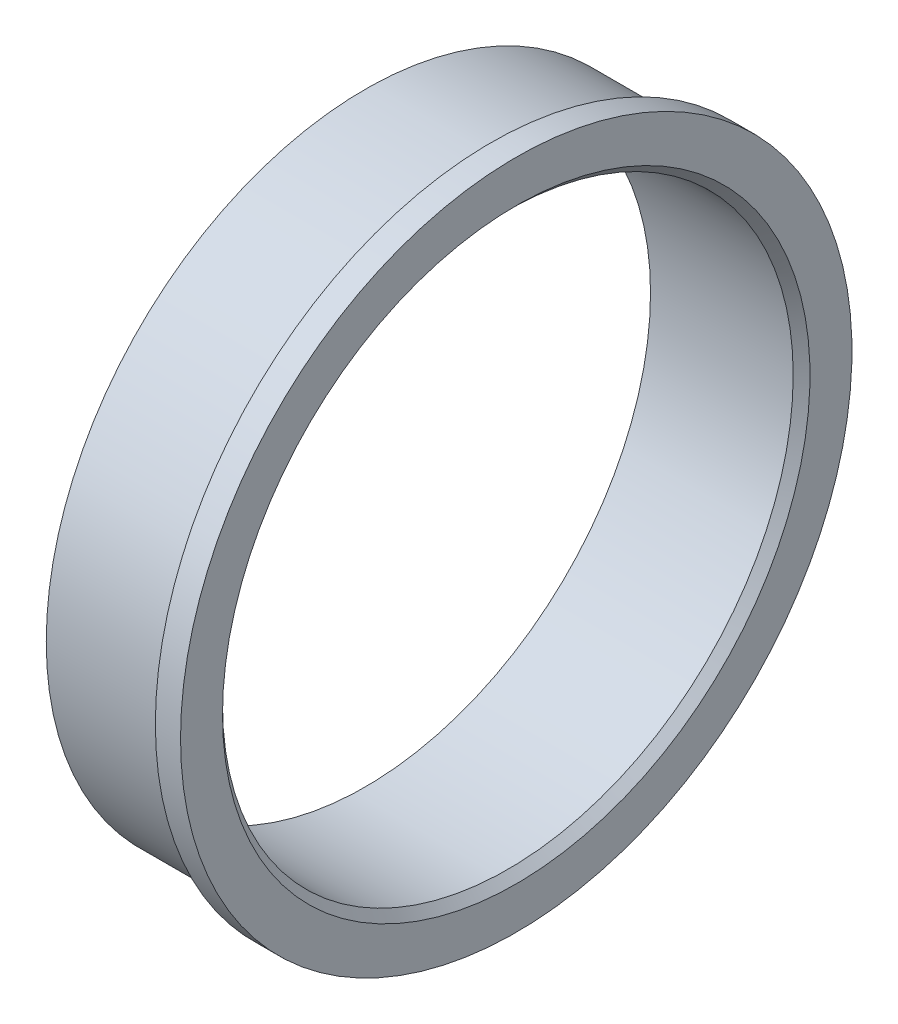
SolidWorks part; units mm, degrees
ref_plane "Plan de face" through (0, 0, 0) normal (0, 0, 1) x (1, 0, 0)
ref_plane "Plan de dessus" through (0, 0, 0) normal (0, 1, 0) x (1, 0, 0)
ref_plane "Plan de droite" through (0, 0, 0) normal (1, 0, 0) x (0, 0, -1)
sketch "Esquisse1" plane through (0, 0, 0) normal (0, 0, 1) x (1, 0, 0)
  line L0 (0, 0) -> (9, 0) construction
  line L1 (0, 17) -> (8.5, 17)
  line L2 (0, 17) -> (0, 19)
  line L3 (0, 19) -> (7.5, 19)
  line L4 (7.5, 19) -> (7.5, 20)
  line L5 (7.5, 20) -> (9, 20)
  line L6 (9, 20) -> (9, 17.5)
  line L7 (8.5, 17) -> (9, 17.5)
  dimension "D1" = 34
  dimension "D2" = 1.5
  dimension "D3" = 9
  dimension "D4" = 38
  dimension "D5" = 40
  dimension "D6" = 9
  dimension "D8" = 0.5
revolve "Révolution1" add sketch "Esquisse1" angle 360 about L0
